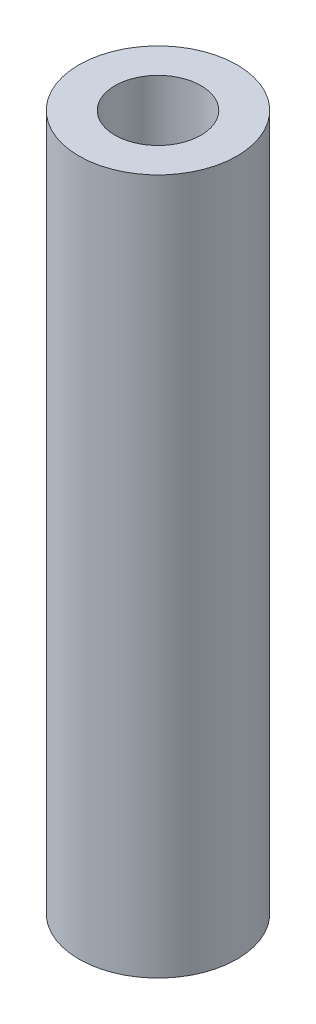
SolidWorks part; units mm, degrees
ref_plane "Front Plane" through (0, 0, 0) normal (0, 0, 1) x (1, 0, 0)
ref_plane "Top Plane" through (0, 0, 0) normal (0, 1, 0) x (1, 0, 0)
ref_plane "Right Plane" through (0, 0, 0) normal (1, 0, 0) x (0, 0, -1)
sketch "Sketch1" plane through (0, 0, 0) normal (0, 1, 0) x (1, 0, 0)
  circle A0 centre (0, 0) radius 3.175
  dimension "D1" = 6.35
extrude "Extrude1" add sketch "Sketch1" against normal blind 27.94
hole_wizard "#8-32 Tapped Hole1" positions "3DSketch1" profile "Sketch2" tap size "#8-32" standard "Ansi Inch"
sketch3d "3DSketch1"
  point P0 (0, 0, 0)
  point P4 (0, 0, 0)
  point P6 (0, 0, 0)
  point P8 (0, 0, 0)
sketch "Sketch2" plane through (0, 0, 0) normal (1, 0, 0) x (0, 0, 1)
  line L0 (0, 0) -> (0, 13.3314)
  line L1 (0, 13.3314) -> (1.7272, 12.2936)
  line L2 (1.7272, 12.2936) -> (1.7272, 0)
  line L5 (1.7272, 0) -> (0, 0)
  line L10 (0, 13.3314) -> (-1.7272, 12.2936) construction
  line L11 (0, -6.35) -> (0, 107.95) construction
  dimension "Tap Drill Dia." = 3.4544
  dimension "Tap Drill Depth" = 12.2936
  dimension "Drill Angle" = 118
hole_wizard "#8-32 Tapped Hole2" positions "3DSketch2" profile "Sketch3" tap size "#8-32" standard "Ansi Inch"
sketch3d "3DSketch2"
  point P0 (0, -27.94, 0)
sketch "Sketch3" plane through (0, -27.94, 0) normal (1, 0, 0) x (0, 0, -1)
  line L0 (0, 0) -> (0, 13.3314)
  line L1 (0, 13.3314) -> (1.7272, 12.2936)
  line L2 (1.7272, 12.2936) -> (1.7272, 0)
  line L5 (1.7272, 0) -> (0, 0)
  line L10 (0, 13.3314) -> (-1.7272, 12.2936) construction
  line L11 (0, -6.35) -> (0, 107.95) construction
  dimension "Tap Drill Dia." = 3.4544
  dimension "Tap Drill Depth" = 12.2936
  dimension "Drill Angle" = 118
